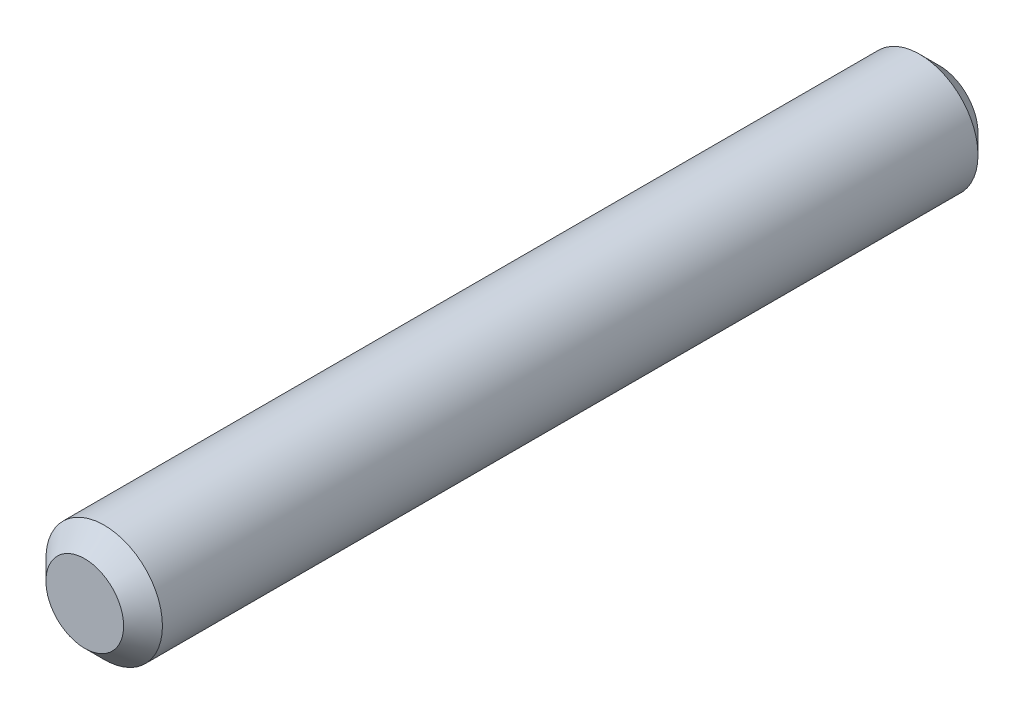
SolidWorks part; units mm, degrees
ref_plane "Спереди" through (0, 0, 0) normal (0, 0, 1) x (1, 0, 0)
ref_plane "Сверху" through (0, 0, 0) normal (0, 1, 0) x (1, 0, 0)
ref_plane "Справа" through (0, 0, 0) normal (1, 0, 0) x (0, 0, -1)
sketch "Эскиз1" plane through (0, 0, 0) normal (0, 0, 1) x (1, 0, 0)
  circle A0 centre (0, 0) radius 0.75
  dimension "D1" = 1.5
extrude "Бобышка-Вытянуть1" add sketch "Эскиз1" along normal mid plane 11
chamfer "Фаска1" distance 0.25 angle 45 2 edges at (0.75, 0, -5.5) (0.75, 0, 5.5)
